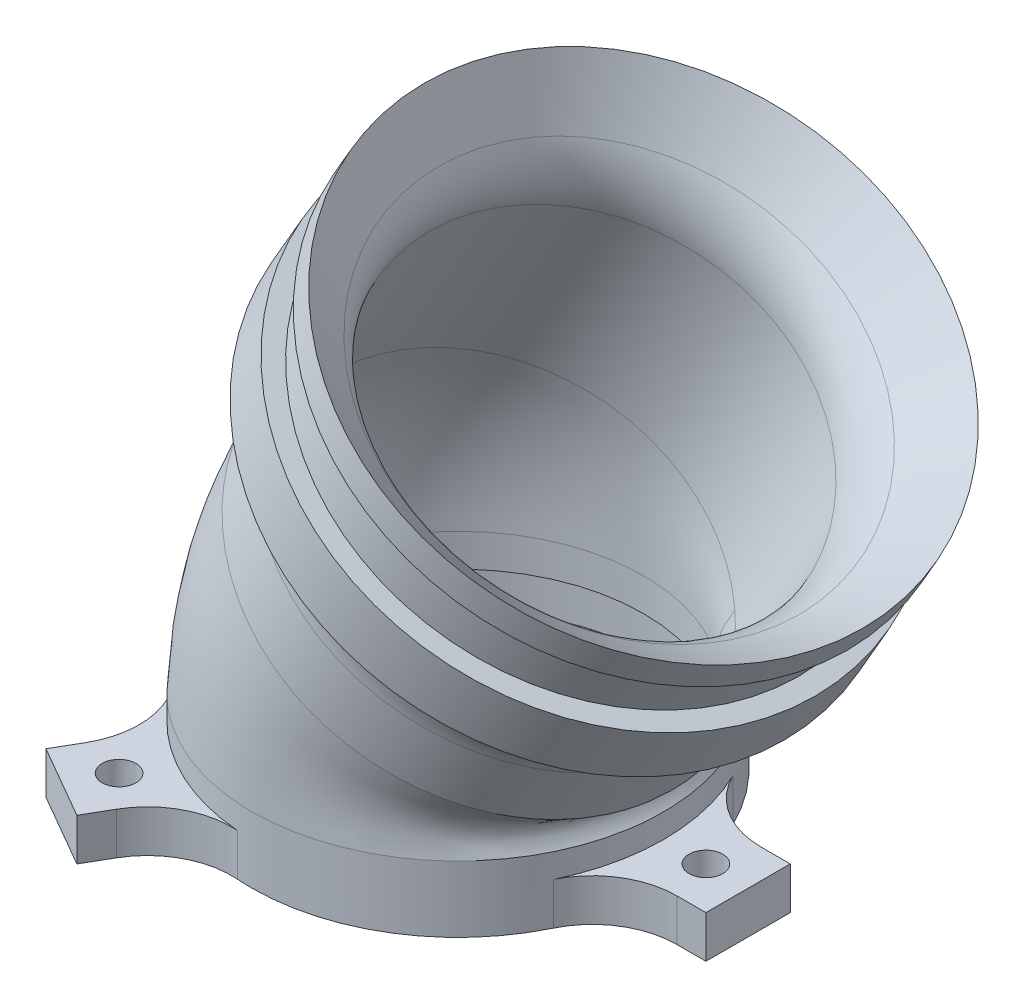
SolidWorks part; units mm, degrees
ref_plane "前视基准面" through (0, 0, 0) normal (0, 0, 1) x (1, 0, 0)
ref_plane "上视基准面" through (0, 0, 0) normal (0, 1, 0) x (1, 0, 0)
ref_plane "右视基准面" through (0, 0, 0) normal (1, 0, 0) x (0, 0, -1)
sketch "草图17" plane through (0, 0, 0) normal (0, 1, 0) x (1, 0, 0)
  circle A0 centre (0, 0) radius 22
  circle A1 centre (0, 0) radius 24.4
sketch "草图20" plane through (0, 0, 0) normal (0, 0, 1) x (1, 0, 0)
  line L0 (0, 0) -> (0, 10)
  line L1 (2.6795, 20) -> (12.6795, 37.3205)
  arc A0 (0, 10) -> (2.6795, 20) centre (20, 10) cw
sweep "扫描2" add profiles "草图17" path "草图20"
sketch "草图21" plane through (0, 0, 0) normal (0, -1, 0) x (1, 0, 0)
  line L0 (34.4, -5) -> (34.4, 5)
  line L1 (34.4, 5) -> (23.8822, 5)
  line L2 (-12.8699, 32.2913) -> (-21.5301, 27.2913)
  line L3 (-21.5301, 27.2913) -> (-16.2712, 18.1826)
  line L4 (-12.8699, 32.2913) -> (-7.611, 23.1826)
  line L5 (34.4, -5) -> (23.8822, -5)
  line L6 (-21.5301, -27.2913) -> (-12.8699, -32.2913)
  line L7 (-12.8699, -32.2913) -> (-7.611, -23.1826)
  line L8 (-21.5301, -27.2913) -> (-16.2712, -18.1826)
  circle A1 centre (-14.7, 25.4611) radius 2
  arc A3 (-7.611, 23.1826) -> (-16.2712, 18.1826) centre (0, 0) ccw
  circle A4 centre (29.4, 0) radius 2
  arc A5 (23.8822, -5) -> (23.8822, 5) centre (0, 0) ccw
  circle A6 centre (-14.7, -25.4611) radius 2
  arc A7 (-16.2712, -18.1826) -> (-7.611, -23.1826) centre (0, 0) ccw
  point P23 (0, 0)
  dimension "D2" = 5
  dimension "D3" = 3
extrude "凸台-拉伸5" add sketch "草图21" against normal blind 5
fillet "圆角5" radius 10 6 edges at (-7.611, 2.5, -23.1826) (23.8822, 2.5, -5) (23.8822, 2.5, 5) (-7.611, 2.5, 23.1826) (-16.2712, 2.5, -18.1826) (-16.2712, 2.5, 18.1826)
sketch "草图22" plane through (0, 0, 0) normal (0, -1, 0) x (1, 0, 0)
  circle A1 centre (0, 0) radius 23.2
extrude "切除-拉伸4" cut sketch "草图22" against normal blind 5
sketch "草图23" plane through (19.3301, 33.4808, 0) normal (0.5, 0.866, 0) x (0.866, -0.5, 0)
  circle A1 centre (-7.6795, 0) radius 30
extrude "凸台-拉伸7" add sketch "草图23" along normal blind 10
fillet "圆角6" radius 10 1 edges at (12.6795, 37.3205, 24.4)
sketch "草图24" plane through (24.3301, 42.141, 0) normal (0.5, 0.866, 0) x (0.866, -0.5, 0)
  circle A0 centre (-7.6795, 0) radius 22
extrude "切除-拉伸5" cut sketch "草图24" against normal blind 10
sketch "草图25" plane through (0, 0, 0) normal (0, 0, 1) x (1, 0, 0)
  line L0 (49.0388, 33.65) -> (45.2034, 27.0069)
  line L1 (49.0388, 33.65) -> (44.2484, 36.4158)
  line L2 (45.2034, 27.0069) -> (40.4129, 29.7726)
  line L3 (44.2484, 36.4158) -> (40.4129, 29.7726)
sketch "草图26" plane through (0, 0, 0) normal (0, 0, 1) x (1, 0, 0)
  line L0 (36.7321, 34.9808) -> (43.6603, 30.9808)
  line L1 (36.7321, 34.9808) -> (-1.3731, 56.9808) construction
  line L2 (43.6603, 30.9808) -> (-8.3013, 60.9808) construction
  line L3 (43.6603, 30.9808) -> (47.9781, 38.4595)
  line L4 (47.9781, 38.4595) -> (36.7321, 34.9808)
  point P6 (49.411, 40.9414)
  point P9 (42.3052, 21.987)
  point P10 (47.7331, 38.6009)
  point P11 (0, 0)
revolve "旋转1" add sketch "草图26" angle 360 about axis through (17.6795, 45.9808, 0) along (-0.5, -0.866, 0)
revolve "切除-旋转2" cut sketch "草图25" angle 360
fillet "圆角8" radius 10 1 edges at (-1.3731, 56.9808, 0)
